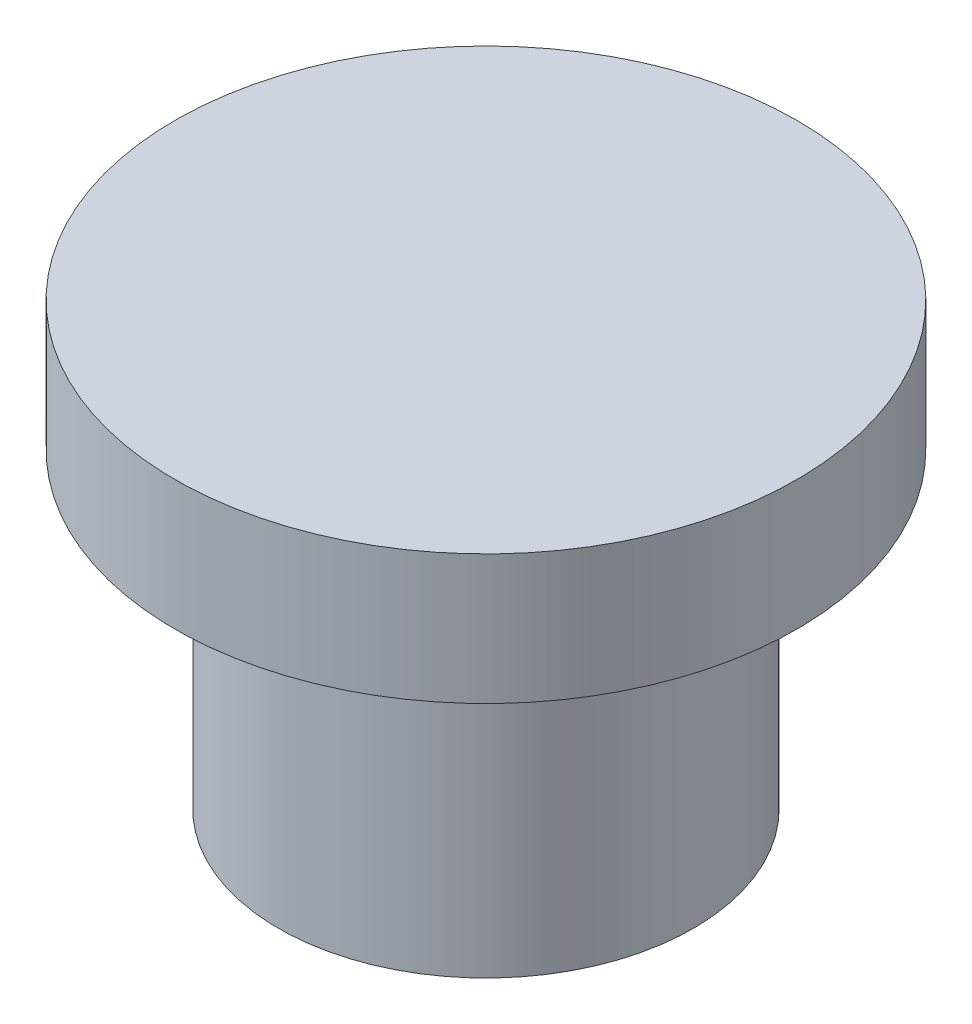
SolidWorks part; units mm, degrees
ref_plane "Front Plane" through (0, 0, 0) normal (0, 0, 1) x (1, 0, 0)
ref_plane "Top Plane" through (0, 0, 0) normal (0, 1, 0) x (1, 0, 0)
ref_plane "Right Plane" through (0, 0, 0) normal (1, 0, 0) x (0, 0, -1)
sketch "Sketch1" plane through (0, 0, 0) normal (0, 0, 1) x (1, 0, 0)
  line L0 (0, 0) -> (0, 3.4) construction
  line L1 (0, 3.4) -> (2.4, 3.4)
  line L2 (2.4, 3.4) -> (2.4, 2.4)
  line L3 (2.4, 2.4) -> (1.6, 2.4)
  line L4 (1.6, 2.4) -> (1.6, 0)
  line L5 (1.6, 0) -> (0, 0)
  line L6 (0, 0) -> (0, 3.4)
  dimension "D1" = 3.2
  dimension "D2" = 4.8
  dimension "D3" = 2.4
  dimension "D4" = 1
revolve "Revolve1" add sketch "Sketch1" angle 360 about L0
